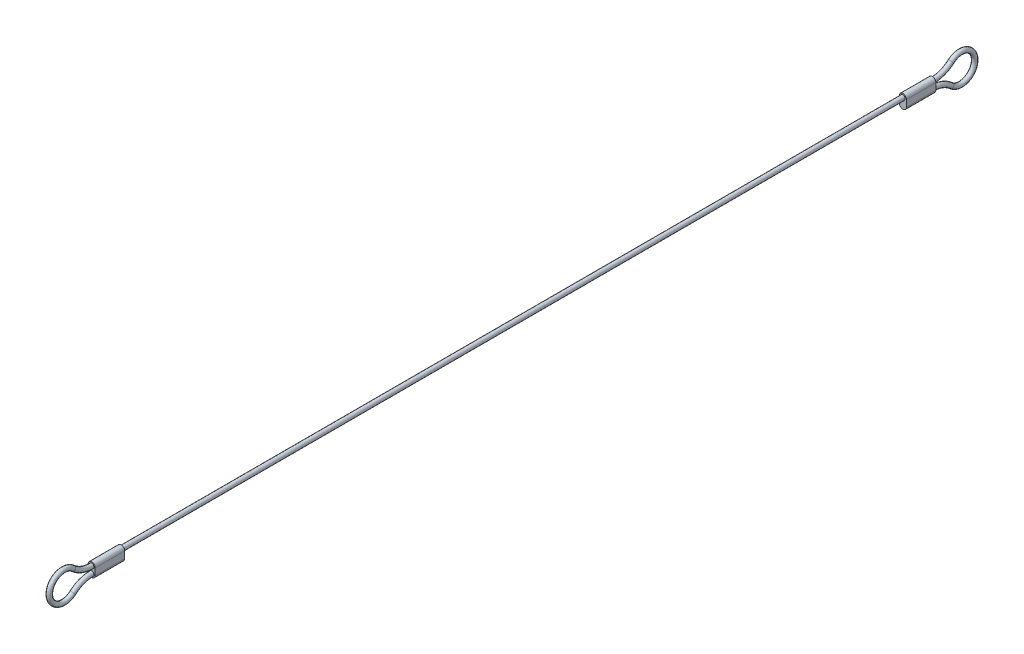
SolidWorks part; units mm, degrees
ref_plane "Front Plane" through (0, 0, 0) normal (0, 0, 1) x (1, 0, 0)
ref_plane "Top Plane" through (0, 0, 0) normal (0, 1, 0) x (1, 0, 0)
ref_plane "Right Plane" through (0, 0, 0) normal (1, 0, 0) x (0, 0, -1)
sketch "Sketch1" plane through (0, 0, 0) normal (1, 0, 0) x (0, 0, -1)
  line L0 (142.8, 0) -> (-142.8, 0)
  line L1 (0, 1.32) -> (0, -1.32) construction
  arc A0 (-142.8, 0) -> (-149.2, 2.4446) centre (-142.8, 9.6) cw
  arc A1 (-149.2, 2.4446) -> (-149.2, -4.7108) centre (-152.4, -1.1331) ccw
  arc A2 (-149.2, -4.7108) -> (-142.8, -2.2663) centre (-142.8, -11.8663) cw
  arc A3 (149.2, -4.7108) -> (142.8, -2.2663) centre (142.8, -11.8663) ccw
  arc A4 (149.2, 2.4446) -> (149.2, -4.7108) centre (152.4, -1.1331) cw
  arc A5 (142.8, 0) -> (149.2, 2.4446) centre (142.8, 9.6) ccw
  point P18 (0, 0)
  dimension "D1" = 4.8
  dimension "D4" = 9.6
  dimension "D2" = 152.4
  dimension "D3" = 9.6
sketch "Sketch2" plane through (0, 0, 0) normal (0, 0, 1) x (1, 0, 0)
  circle A0 centre (0, 0) radius 0.795
  dimension "D1" = 1.59
sweep "Sweep1" add profiles "Sketch2" path "Sketch1"
sketch "Sketch3" plane through (0, 0, 142.8) normal (0, 0, -1) x (-1, 0, 0)
  line L0 (0, 0) -> (0, -2.2663) construction
  line L1 (1.2, 0) -> (1.2, -2.2663)
  line L2 (-1.2, 0) -> (-1.2, -2.2663)
  line L3 (-0.795, -2.2663) -> (0.795, -2.2663) construction
  arc A0 (1.2, 0) -> (-1.2, 0) centre (0, 0) ccw
  arc A1 (-1.2, -2.2663) -> (1.2, -2.2663) centre (0, -2.2663) ccw
  point P3 (0, -1.1331)
  dimension "D1" = 2.4
extrude "Boss-Extrude1" add sketch "Sketch3" along normal blind 10
mirror "Mirror1" about plane through (0, 0, 0) normal (0, 0, 1) of "Boss-Extrude1"
